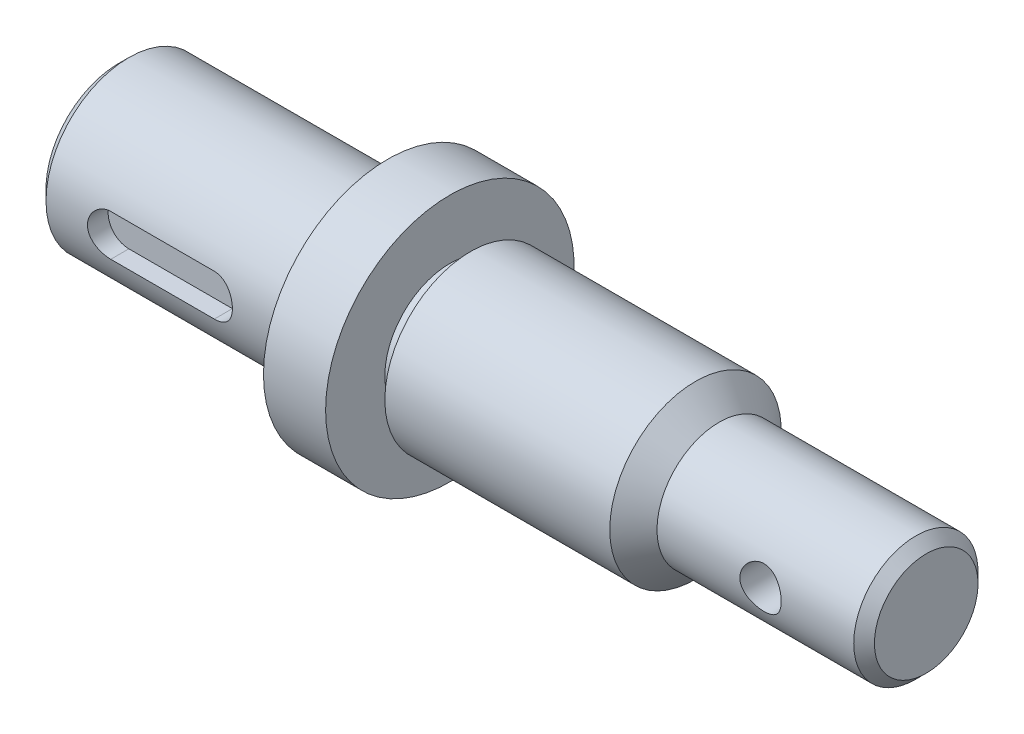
SolidWorks part; units mm, degrees
ref_plane "前视基准面" through (0, 0, 0) normal (0, 0, 1) x (1, 0, 0)
ref_plane "上视基准面" through (0, 0, 0) normal (0, 1, 0) x (1, 0, 0)
ref_plane "右视基准面" through (0, 0, 0) normal (1, 0, 0) x (0, 0, -1)
sketch "草图2" plane through (0, 0, 0) normal (0, 0, 1) x (1, 0, 0)
  line L0 (-89.9218, 0) -> (108.3879, 0) construction
  line L1 (0, 0) -> (0, 4)
  line L2 (0, 4) -> (12, 4)
  line L3 (12, 4) -> (12, 3)
  line L4 (12, 3) -> (13, 3)
  line L5 (13, 3) -> (13, 6)
  line L6 (13, 6) -> (16, 6)
  line L7 (16, 6) -> (16, 3.14)
  line L8 (16, 3.14) -> (17, 3.14)
  line L9 (17, 3.14) -> (17, 4.14)
  line L10 (17, 4.14) -> (27.86, 4.14)
  line L12 (29, 3) -> (39, 3)
  line L13 (39, 3) -> (39, 0)
  line L14 (39, 0) -> (0, 0)
  line L15 (29, 3) -> (27.86, 4.14)
  dimension "D1" = 4
  dimension "D2" = 12
  dimension "D3" = 1
  dimension "D4" = 1
  dimension "D5" = 3
  dimension "D6" = 3
  dimension "D7" = 1
  dimension "D8" = 1
  dimension "D10" = 3
  dimension "D11" = 10
revolve "旋转1" add sketch "草图2" angle 360 about L0
chamfer "倒角1" distance 0.5 angle 45 1 edges at (0, 0, 4)
chamfer "倒角2" distance 0.5 angle 45 1 edges at (39, 0, 3)
ref_plane "基准面1" through (0, 0, 4) normal (0, 0, 1) x (1, 0, 0)
sketch "草图3" plane through (0, 0, 4) normal (0, 0, 1) x (1, 0, 0)
  line L0 (0, 0) -> (12, 0) construction
  line L1 (12, -3) -> (12, 3) construction
  line L2 (3.5, 1) -> (8.5, 1)
  line L3 (8.5, -1) -> (3.5, -1)
  line L4 (0, 3.5) -> (0, -3.5) construction
  arc A0 (8.5, 1) -> (8.5, -1) centre (8.5, 0) cw
  arc A1 (3.5, -1) -> (3.5, 1) centre (3.5, 0) cw
  dimension "D3" = 1
  dimension "D1" = 3.5
  dimension "D2" = 5
extrude "切除-拉伸1" cut sketch "草图3" against normal blind 1
sketch "草图4" plane through (0, 0, 4) normal (0, 0, 1) x (1, 0, 0)
  line L0 (39, -2.5) -> (39, 2.5) construction
  circle A0 centre (34, 0) radius 1
  dimension "D2" = 2
  dimension "D1" = 5
extrude "切除-拉伸2" cut sketch "草图4" against normal through all
sketch "草图5" plane through (0, 0, 0) normal (0, 1, 0) x (1, 0, 0)
  line L1 (-1.3134, 10.0563) -> (6.3659, 10.0563)
  line L2 (-1.3134, 10.0563) -> (-1.3134, -9.0202)
  line L3 (-1.3134, -9.0202) -> (6.3659, -9.0202)
  line L4 (6.3659, 10.0563) -> (6.3659, -9.0202)
  line L5 (40.3134, 7.5574) -> (34.0359, 7.5574)
  line L6 (40.3134, 7.5574) -> (40.3134, -7.7403)
  line L7 (40.3134, -7.7403) -> (34.0359, -7.7403)
  line L8 (34.0359, 7.5574) -> (34.0359, -7.7403)
extrude "切除-拉伸3" [suppressed] cut sketch "草图5" against normal through all and the other way through all
sketch "草图6" plane through (0, 0, 0) normal (0, 0, 1) x (1, 0, 0)
  line L1 (7.0363, 9.6296) -> (40.1306, 9.6296)
  line L2 (7.0363, 9.6296) -> (7.0363, -10.7267)
  line L3 (7.0363, -10.7267) -> (40.1306, -10.7267)
  line L4 (40.1306, 9.6296) -> (40.1306, -10.7267)
extrude "切除-拉伸4" [suppressed] cut sketch "草图6" against normal through all and the other way through all
sketch "草图7" plane through (0, 0, 0) normal (0, 1, 0) x (1, 0, 0)
  line L1 (-1.3744, 11.458) -> (34.2187, 11.458)
  line L2 (-1.3744, 11.458) -> (-1.3744, -9.3858)
  line L3 (-1.3744, -9.3858) -> (34.2187, -9.3858)
  line L4 (34.2187, 11.458) -> (34.2187, -9.3858)
extrude "切除-拉伸5" [suppressed] cut sketch "草图7" against normal through all and the other way through all
